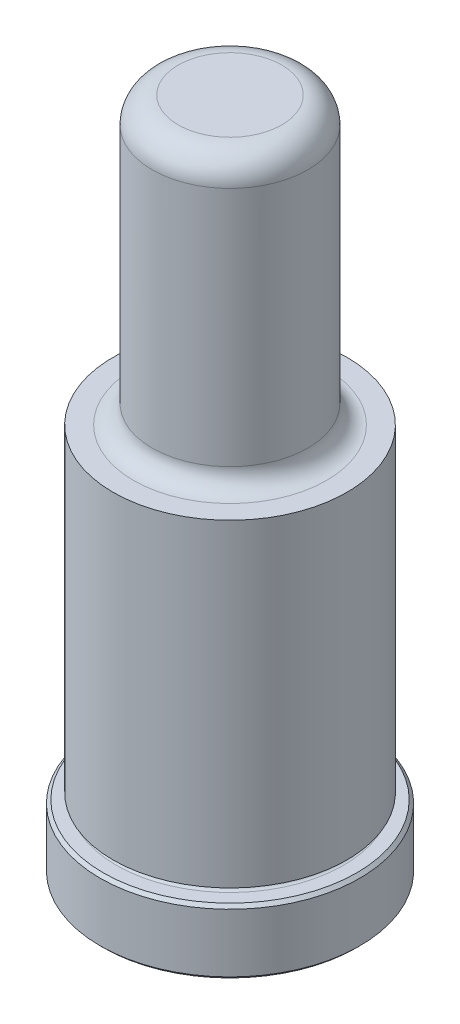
SolidWorks part; units mm, degrees
ref_plane "Front Plane" through (0, 0, 0) normal (0, 0, 1) x (1, 0, 0)
ref_plane "Top Plane" through (0, 0, 0) normal (0, 1, 0) x (1, 0, 0)
ref_plane "Right Plane" through (0, 0, 0) normal (1, 0, 0) x (0, 0, -1)
sketch "Sketch1" plane through (0, 0, 0) normal (1, 0, 0) x (0, 0, -1)
  line L0 (0, 0) -> (15.875, 0)
  line L1 (15.875, 0) -> (15.875, 7.9248)
  line L2 (15.875, 7.9248) -> (13.8938, 7.9248)
  line L3 (13.5128, 2.6782) -> (13.5128, 5.9795) construction
  line L4 (13.8938, 8.6868) -> (14.3002, 8.6868)
  line L5 (14.3002, 8.6868) -> (14.3002, 47.625)
  line L6 (14.3002, 47.625) -> (11.7983, 47.625)
  line L7 (9.5123, 49.911) -> (9.5123, 82.55)
  line L9 (9.5123, 82.55) -> (0, 82.55)
  line L10 (0, 82.55) -> (0, 0)
  line L11 (0, 0) -> (0, -7.2694) construction
  arc A0 (13.8938, 8.6868) -> (13.8938, 7.9248) centre (13.8938, 8.3058) ccw
  arc A1 (11.7983, 47.625) -> (9.5123, 49.911) centre (11.7983, 49.911) cw
  point P2 (9.5123, 82.55)
  point P14 (9.5123, 82.2037)
  point P19 (9.5123, 47.625)
  dimension "D14" = 0.762
  dimension "D8" = 2.286
  dimension "T" = 7.9248
  dimension "D2" = 0.762
  dimension "M" = 31.75
  dimension "B" = 28.6004
  dimension "L" = 82.55
  dimension "D7" = 0.7874
  dimension "A" = 47.625
  dimension "D" = 19.0246
  dimension "D15" = 34.925
revolve "Revolve1" add sketch "Sketch1" angle 360 about L11
chamfer "Chamfer1" distance 0.381 angle 45 2 edges at (0, 0, 15.875) (0, 7.9248, 15.875)
fillet "Fillet1" radius 3.175 1 edges at (0, 82.55, 9.5123)
